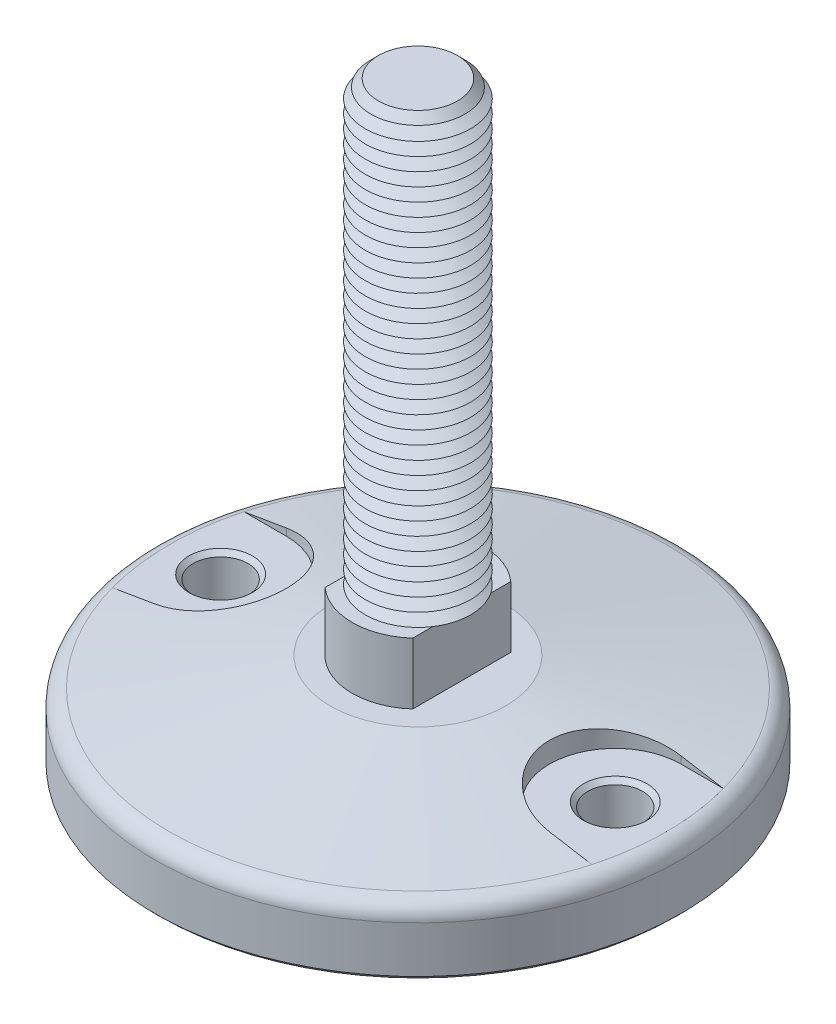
SolidWorks part; units mm, degrees
ref_plane "Front Plane" through (0, 0, 0) normal (0, 0, 1) x (1, 0, 0)
ref_plane "Top Plane" through (0, 0, 0) normal (0, 1, 0) x (1, 0, 0)
ref_plane "Right Plane" through (0, 0, 0) normal (1, 0, 0) x (0, 0, -1)
sketch "Sketch1" plane through (0, 0, 0) normal (1, 0, 0) x (0, 0, -1)
  line L0 (0, 61.3389) -> (0, -58.404) construction
sketch "Sketch2" plane through (0, 0, 0) normal (1, 0, 0) x (0, 0, -1)
  line L0 (0, 0) -> (-20, 0)
  line L1 (-20, 0) -> (-60, -7.0531)
  line L2 (-60, -7.0531) -> (-60, -22)
  line L3 (-60, -22) -> (0, -22)
  line L4 (0, 61.3389) -> (0, -58.404) construction
  line L5 (0, -22) -> (0, 0)
  dimension "D1" = 22
  dimension "D2" = 60
  dimension "D3" = 20
  dimension "D4" = 10
revolve "Revolve1" add sketch "Sketch2" angle 360 about L0
fillet "Fillet1" radius 4 1 edges at (0, -7.0531, 60)
sketch "Sketch3" plane through (0, 0, 0) normal (0, 1, 0) x (1, 0, 0)
  circle A0 centre (0, 0) radius 15
  dimension "D1" = 30
extrude "Boss-Extrude1" add sketch "Sketch3" along normal blind 14
sketch "Sketch4" plane through (0, 14, 0) normal (0, 1, 0) x (1, 0, 0)
  line L0 (-10, 11.1803) -> (-10, -11.1803)
  line L2 (10, -11.1803) -> (10, 11.1803)
  arc A0 (-10, 11.1803) -> (-10, -11.1803) centre (0, 0) ccw
  circle A1 centre (0, 0) radius 15 construction
  arc A2 (10, -11.1803) -> (10, 11.1803) centre (0, 0) ccw
  dimension "D1" = 20
extrude "Cut-Extrude1" cut sketch "Sketch4" against normal blind 14
sketch "Sketch5" plane through (0, 14, 0) normal (0, 1, 0) x (1, 0, 0)
  circle A0 centre (0, 0) radius 12
  dimension "D1" = 24
extrude "Boss-Extrude2" add sketch "Sketch5" along normal blind 100
chamfer "Chamfer1" distance 3 angle 45 1 edges at (0, 114, 12)
sketch "Sketch6" plane through (0, 0, 0) normal (1, 0, 0) x (0, 0, -1)
  line L0 (-12, 14) -> (-9.4019, 15.5)
  line L1 (-9.4019, 15.5) -> (-12, 17)
  line L2 (-12, 111) -> (-12, 14) construction
  line L3 (-12, 17) -> (-12, 14)
  dimension "D1" = 3
revolve "Cut-Revolve1" cut sketch "Sketch6" angle 360 about L0
pattern_linear "LPattern1" count 33 spacing 3 along (0, 1, 0) of "Cut-Revolve1"
sketch "Sketch8" plane through (0, 0, 0) normal (0, 1, 0) x (1, 0, 0)
  line L0 (-45, 15) -> (-54.6743, 15)
  line L1 (-45, -15) -> (-54.6743, -15)
  arc A1 (-54.6743, 15) -> (-54.6743, -15) centre (0, 0) ccw
  circle A2 centre (0, 0) radius 56.6946 construction
  arc A3 (-45, -15) -> (-45, 15) centre (-45, 0) ccw
  point P3 (-45, 0)
  point P11 (0, 0)
  dimension "D1" = 45
  dimension "D2" = 30
extrude "Cut-Extrude4" cut sketch "Sketch8" against normal blind 6.47
sketch "Sketch10" plane through (0, -6.47, 0) normal (0, 1, 0) x (1, 0, 0)
  circle A0 centre (-45, 0) radius 6.25
  dimension "D1" = 12.5
extrude "Cut-Extrude5" cut sketch "Sketch10" against normal up to surface (15.53 mm away)
chamfer "Chamfer2" distance 1 angle 45 2 edges at (-45, -22, -6.25) (-45, -6.47, 6.25)
mirror "Mirror1" about plane through (0, 0, 0) normal (1, 0, 0) of "Chamfer2", "Cut-Extrude5", "Cut-Extrude4"
chamfer "Chamfer3" distance 1 angle 45 1 edges at (0, -22, 60)
